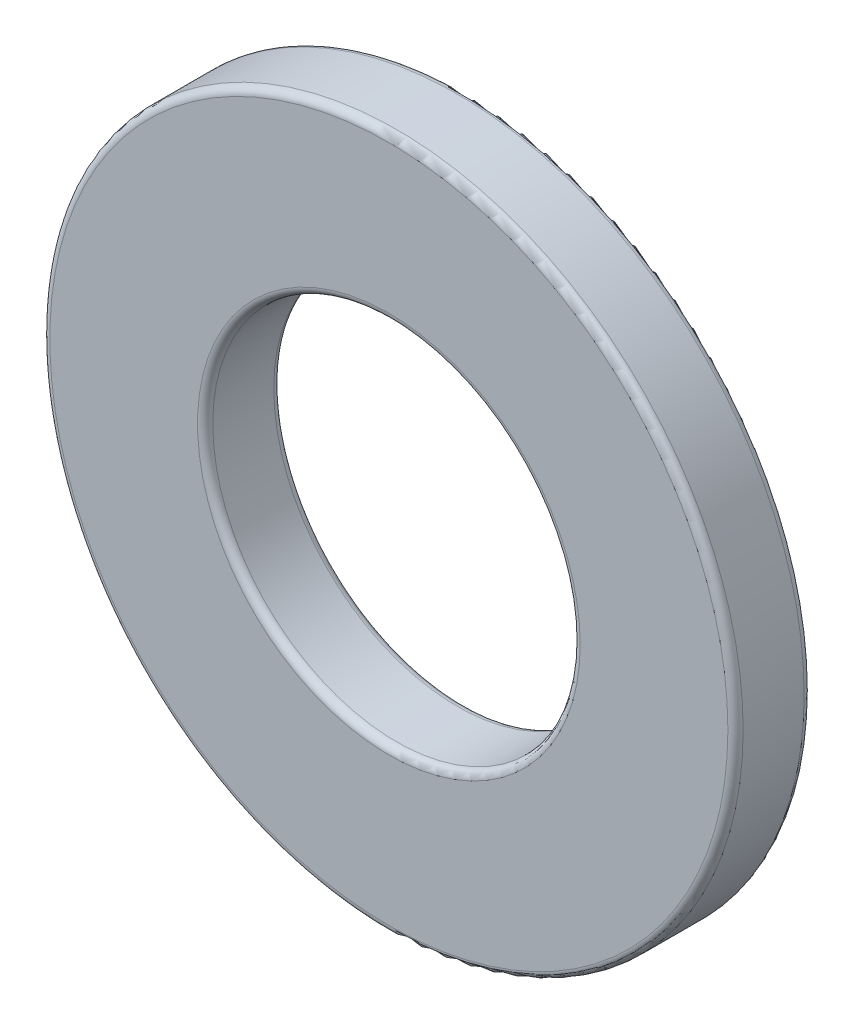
SolidWorks part; units mm, degrees
ref_plane "Front Plane" through (0, 0, 0) normal (0, 0, 1) x (1, 0, 0)
ref_plane "Top Plane" through (0, 0, 0) normal (0, 1, 0) x (1, 0, 0)
ref_plane "Right Plane" through (0, 0, 0) normal (1, 0, 0) x (0, 0, -1)
sketch "Sketch1" plane through (0, 0, 0) normal (0, 0, 1) x (1, 0, 0)
  circle A0 centre (0, 0) radius 5 construction
  circle A1 centre (0, 0) radius 2.65 construction
  dimension "OD" = 10
  dimension "ID" = 5.3
sketch "Sketch2" plane through (0, 0, 0) normal (1, 0, 0) x (0, 0, -1)
  line L0 (-0.55, -5) -> (0.55, -5) construction
  point P0 (0.35, -5)
  point P4 (0, -5)
sketch "Sketch3" plane through (0, 0, 0) normal (0, 0, 1) x (1, 0, 0)
  circle A0 centre (0, 0) radius 5 construction
  circle A1 centre (0, 0) radius 5
  circle A2 centre (0, 0) radius 2.65 construction
  circle A3 centre (0, 0) radius 2.65
extrude "Boss-Extrude1" add sketch "Sketch3" against normal up to vertex (0.55 mm away) and the other way up to vertex (0.55 mm away)
fillet "Fillet1" radius 0.11 4 edges at (5, 0, -0.55) (2.65, 0, -0.55) (2.65, 0, 0.55) (5, 0, 0.55)
equation "\"D1@Fillet1\" = \"Thickness Max@Sketch2\" * 0.1"
